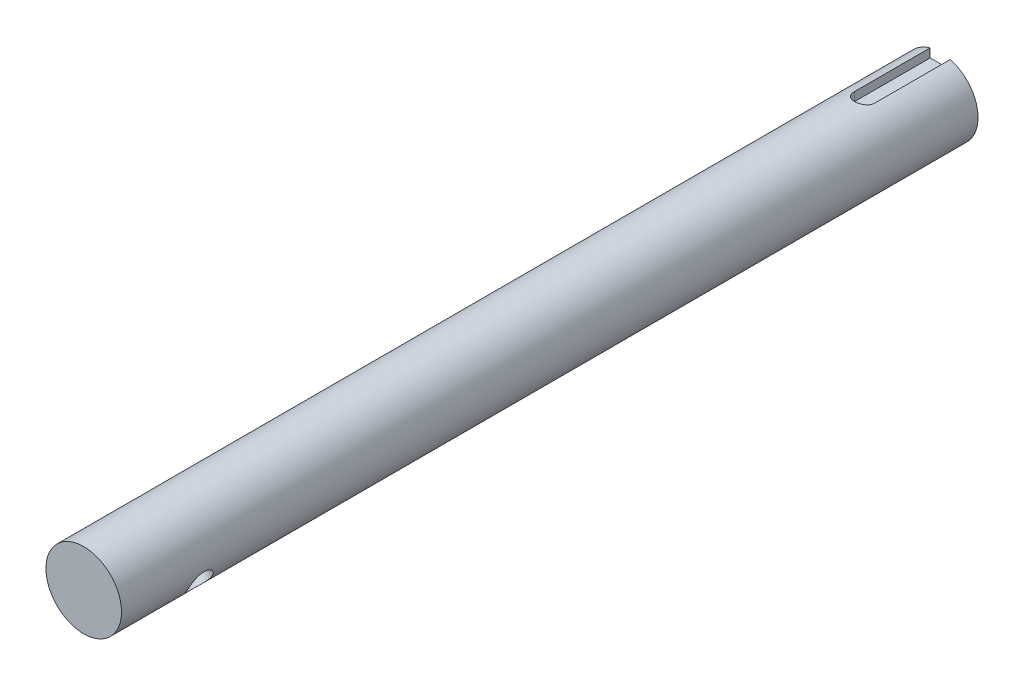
SolidWorks part; units mm, degrees
ref_plane "Face" through (0, 0, 0) normal (0, 0, 1) x (1, 0, 0)
ref_plane "Dessus" through (0, 0, 0) normal (0, 1, 0) x (1, 0, 0)
ref_plane "Droite" through (0, 0, 0) normal (1, 0, 0) x (0, 0, -1)
sketch "Esquisse1" plane through (0, 0, 0) normal (0, 0, 1) x (1, 0, 0)
  circle A0 centre (0, 0) radius 15
  dimension "D1" = 30
extrude "Base-Extrusion" add sketch "Esquisse1" along normal blind 340
sketch "Esquisse2" plane through (0, 0, 0) normal (1, 0, 0) x (0, 0, -1)
  line L0 (-30, 11) -> (0, 11)
  line L1 (0, -15) -> (0, 15) construction
  line L2 (0, 11) -> (0, 15)
  line L3 (0, 15) -> (-340, 15) construction
  line L4 (0, 15) -> (-30, 15)
  line L5 (-30, 15) -> (-30, 11)
  dimension "D2" = 30
  dimension "D1" = 11
extrude "Enlèv. mat.-Extru.1" cut sketch "Esquisse2" against normal mid plane 8
sketch "Esquisse5" plane through (0, 11, 0) normal (0, 1, 0) x (-1, 0, 0)
  line L0 (4, 0) -> (4, 30) construction
  line L1 (-4, 0) -> (-4, 30) construction
  line L2 (-4, 30) -> (4, 30) construction
  circle A0 centre (0, 30) radius 4
extrude "Enlèv. mat.-Extru.2" cut sketch "Esquisse5" along normal through all
hole_wizard "M8x1.25 Trou taraudé1" positions "Esquisse4" profile "Esquisse3" tap size "M8x1.25" standard "Ansi Métrique"
sketch "Esquisse4" plane through (0, 0, 0) normal (0, 0, -1) x (-1, 0, 0)
  point P0 (0, 0)
sketch "Esquisse3" plane through (0, 0, 0) normal (1, 0, 0) x (0, 1, 0)
  line L0 (0, 0) -> (0, 28.2929)
  line L1 (0, 28.2929) -> (3.4, 26.25)
  line L2 (3.4, 26.25) -> (3.4, 0)
  line L5 (3.4, 0) -> (0, 0)
  line L10 (0, 28.2929) -> (-3.4, 26.25) construction
  line L11 (0, -6.35) -> (0, 107.95) construction
  dimension "Diamètre du perçage" = 6.8
  dimension "Profondeur du perçage" = 26.25
  dimension "Angle de pointe" = 118
ref_plane "Plan1" through (0, 0, 0) normal (0.866, -0.5, 0) x (0, 0, -1)
sketch "Esquisse6" plane through (0, 0, 0) normal (0.866, -0.5, 0) x (0, 0, -1)
  line L0 (-340, 0) -> (0, 0) construction
  line L1 (-340, 15) -> (-340, -15) construction
  circle A0 centre (-307, 0) radius 5
  dimension "D2" = 10
  dimension "D1" = 33
extrude "Enlèv. mat.-Extru.3" cut sketch "Esquisse6" against normal through all and the other way through all
